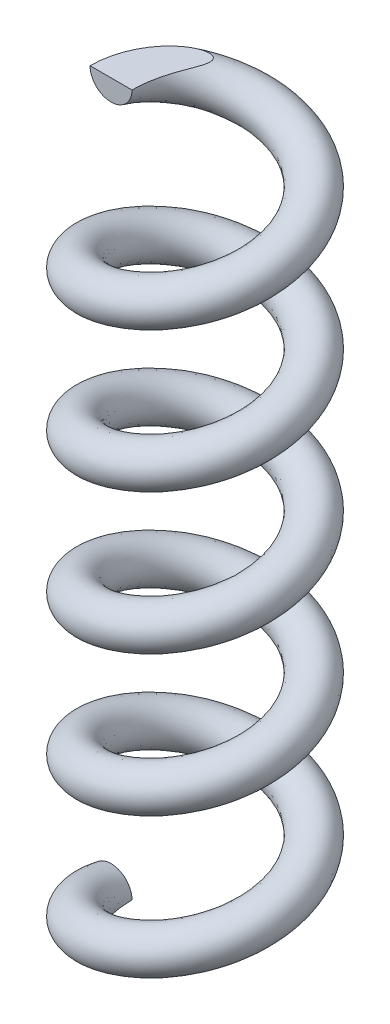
SolidWorks part; units mm, degrees
ref_plane "Front Plane" through (0, 0, 0) normal (0, 0, 1) x (1, 0, 0)
ref_plane "Top Plane" through (0, 0, 0) normal (0, 1, 0) x (1, 0, 0)
ref_plane "Right Plane" through (0, 0, 0) normal (1, 0, 0) x (0, 0, -1)
sketch "Sketch1" plane through (0, 0, 0) normal (0, 0, 1) x (1, 0, 0)
  line L1 (-24, -71.5) -> (-38, -71.5) construction
  circle A0 centre (-38, -71.5) radius 3.5
  dimension "D3" = 7
  dimension "D2" = 14
sketch "Sketch5" plane through (0, 0, 0) normal (0, 0, 1) x (1, 0, 0)
  line L0 (-24, -71.5) -> (-24, 45.459)
  line L3 (-29, 45.459) -> (-19, 45.459) construction
  point P3 (0, 0)
  point P4 (0, 0)
  point P5 (0, 0)
sweep "Sweep3" add profiles "Sketch1" path "Sketch5" parameters "D4"=1800
ref_plane "Plane3" through (0, 45.459, 0) normal (0, 1, 0) x (1, 0, 0)
ref_plane "Plane4" through (0, -71.5, 0) normal (0, 1, 0) x (1, 0, 0)
other "SurfaceCut1"
other "SurfaceCut2"
